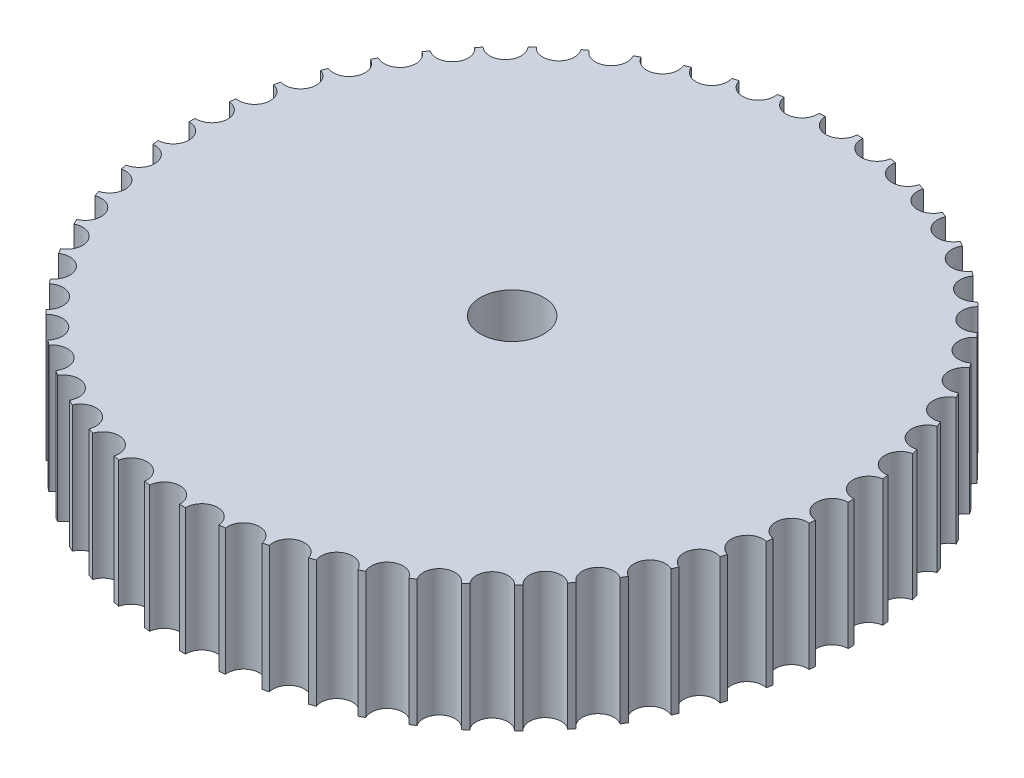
SolidWorks part; units mm, degrees
ref_plane "Спереди" through (0, 0, 0) normal (0, 0, 1) x (1, 0, 0)
ref_plane "Сверху" through (0, 0, 0) normal (0, 1, 0) x (1, 0, 0)
ref_plane "Справа" through (0, 0, 0) normal (1, 0, 0) x (0, 0, -1)
sketch "Sketch1" plane through (0, 0, 0) normal (0, 1, 0) x (1, 0, 0)
  circle A0 centre (0, 0) radius 26
extrude "Boss-Extrude1" add sketch "Sketch1" along normal blind 10
sketch "Sketch3" plane through (0, 0, 0) normal (0, 0, 1) x (1, 0, 0)
  line L0 (0, 0) -> (0, 42.4551) construction
sketch "Sketch4" plane through (0, 10, 0) normal (0, 1, 0) x (1, 0, 0)
  circle A0 centre (0, 26) radius 1.25
  circle A1 centre (0, 0) radius 26 construction
  circle A2 centre (2.9638, 25.8305) radius 1.25
  circle A3 centre (5.8889, 25.3243) radius 1.25
  circle A4 centre (8.7373, 24.488) radius 1.25
  circle A5 centre (11.4717, 23.3324) radius 1.25
  circle A6 centre (14.0567, 21.8726) radius 1.25
  circle A7 centre (16.4583, 20.1277) radius 1.25
  circle A8 centre (18.6454, 18.1204) radius 1.25
  circle A9 centre (20.5895, 15.8768) radius 1.25
  circle A10 centre (22.2651, 13.4263) radius 1.25
  circle A11 centre (23.6504, 10.8008) radius 1.25
  circle A12 centre (24.7275, 8.0344) radius 1.25
  circle A13 centre (25.4821, 5.1634) radius 1.25
  circle A14 centre (25.9046, 2.225) radius 1.25
  circle A15 centre (25.9894, -0.7425) radius 1.25
  circle A16 centre (25.7354, -3.7002) radius 1.25
  circle A17 centre (25.1458, -6.6097) radius 1.25
  circle A18 centre (24.2285, -9.433) radius 1.25
  circle A19 centre (22.9953, -12.1334) radius 1.25
  circle A20 centre (21.4623, -14.6755) radius 1.25
  circle A21 centre (19.6495, -17.0264) radius 1.25
  circle A22 centre (17.5805, -19.1553) radius 1.25
  circle A23 centre (15.2824, -21.0344) radius 1.25
  circle A24 centre (12.7851, -22.6394) radius 1.25
  circle A25 centre (10.121, -23.9492) radius 1.25
  circle A26 centre (7.325, -24.9468) radius 1.25
  circle A27 centre (4.4336, -25.6192) radius 1.25
  circle A28 centre (1.4843, -25.9576) radius 1.25
  circle A29 centre (-1.4843, -25.9576) radius 1.25
  circle A30 centre (-4.4336, -25.6192) radius 1.25
  circle A31 centre (-7.325, -24.9468) radius 1.25
  circle A32 centre (-10.121, -23.9492) radius 1.25
  circle A33 centre (-12.7851, -22.6394) radius 1.25
  circle A34 centre (-15.2824, -21.0344) radius 1.25
  circle A35 centre (-17.5805, -19.1553) radius 1.25
  circle A36 centre (-19.6495, -17.0264) radius 1.25
  circle A37 centre (-21.4623, -14.6755) radius 1.25
  circle A38 centre (-22.9953, -12.1334) radius 1.25
  circle A39 centre (-24.2285, -9.433) radius 1.25
  circle A40 centre (-25.1458, -6.6097) radius 1.25
  circle A41 centre (-25.7354, -3.7002) radius 1.25
  circle A42 centre (-25.9894, -0.7425) radius 1.25
  circle A43 centre (-25.9046, 2.225) radius 1.25
  circle A44 centre (-25.4821, 5.1634) radius 1.25
  circle A45 centre (-24.7275, 8.0344) radius 1.25
  circle A46 centre (-23.6504, 10.8008) radius 1.25
  circle A47 centre (-22.2651, 13.4263) radius 1.25
  circle A48 centre (-20.5895, 15.8768) radius 1.25
  circle A49 centre (-18.6454, 18.1204) radius 1.25
  circle A50 centre (-16.4583, 20.1277) radius 1.25
  circle A51 centre (-14.0567, 21.8726) radius 1.25
  circle A52 centre (-11.4717, 23.3324) radius 1.25
  circle A53 centre (-8.7373, 24.488) radius 1.25
  circle A54 centre (-5.8889, 25.3243) radius 1.25
  circle A55 centre (-2.9638, 25.8305) radius 1.25
  point P121 (0, 0)
  dimension "D1" = 55
extrude "Cut-Extrude1" cut sketch "Sketch4" against normal blind 10
sketch "Sketch5" plane through (0, 10, 0) normal (0, 1, 0) x (1, 0, 0)
  circle A0 centre (0, 0) radius 2.5
extrude "Cut-Extrude2" cut sketch "Sketch5" against normal blind 10 contours A0
sketch3d "Sketch_MAC1-1_MY_PULLEY_MILLING" [suppressed]
  line L0 (-25.995, 10, 25.9989) -> (-25.995, 5, 15.9989)
  line L1 (-25.995, 10, 25.9989) -> (-15.9951, 10, 25.9989)
  point P0 (-25.995, 10, 25.9989)
  point P1 (-25.995, 10, 15.9989)
  point P2 (-15.9951, 10, 25.9989)
